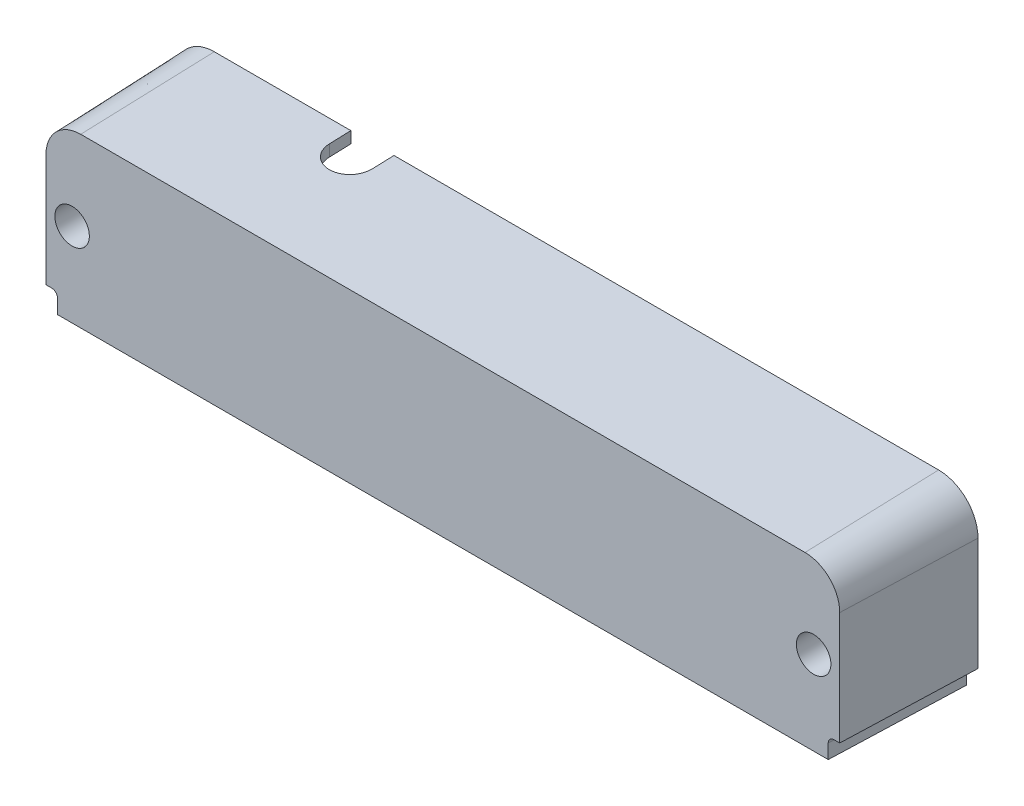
SolidWorks part; units mm, degrees
ref_plane "Front Plane" through (0, 0, 0) normal (0, 0, 1) x (1, 0, 0)
ref_plane "Top Plane" through (0, 0, 0) normal (0, 1, 0) x (1, 0, 0)
ref_plane "Right Plane" through (0, 0, 0) normal (1, 0, 0) x (0, 0, -1)
sketch "Sketch1" plane through (0, 0, 0) normal (0, 0, 1) x (1, 0, 0)
  line L1 (0, 0) -> (139.7, 0)
  line L2 (0, 0) -> (0, 23.15)
  line L3 (6.85, 30) -> (132.85, 30)
  line L4 (139.7, 0) -> (139.7, 23.15)
  arc A0 (139.7, 23.15) -> (132.85, 30) centre (132.85, 23.15) ccw
  arc A1 (0, 23.15) -> (6.85, 30) centre (6.85, 23.15) cw
  point P6 (139.7, 30)
  point P9 (0, 30)
  dimension "D3" = 6.85
  dimension "D1" = 30
  dimension "D2" = 139.7
extrude "Extrude1" add sketch "Sketch1" along normal blind 23.24 draft 2
shell "Shell2" thickness 2
sketch "Sketch2" plane through (0, 0, 23.24) normal (0, 0, 1) x (1, 0, 0)
  line L1 (-5.8064, 0.8116) -> (146.32, 0.8116)
  line L2 (-5.8064, 0.8116) -> (-5.8064, 0)
  line L3 (-5.8064, 0) -> (146.32, 0)
  line L4 (146.32, 0.8116) -> (146.32, 0)
extrude "Extrude2" add sketch "Sketch2" against normal through all
sketch "Sketch4" plane through (0, 0.8116, 0) normal (0, 1, 0) x (-1, 0, 0)
  line L4 (-0.8116, 23.24) -> (0, 0)
  line L5 (0, 0) -> (5.8064, 0)
  line L6 (5.8064, 0) -> (5.8064, 23.24)
  line L7 (5.8064, 23.24) -> (-0.8116, 23.24)
  line L8 (-0.8116, 23.24) -> (0, 0)
  line L9 (0, 0) -> (5.8064, 0)
  line L10 (5.8064, 0) -> (5.8064, 23.24)
  line L11 (5.8064, 23.24) -> (-0.8116, 23.24)
  line L12 (-139.7, 0) -> (-138.8884, 23.24)
  line L13 (-138.8884, 23.24) -> (-146.32, 23.24)
  line L14 (-146.32, 23.24) -> (-146.32, 0)
  line L15 (-146.32, 0) -> (-139.7, 0)
  line L16 (-139.7, 0) -> (-138.8884, 23.24)
  line L17 (-138.8884, 23.24) -> (-146.32, 23.24)
  line L18 (-146.32, 23.24) -> (-146.32, 0)
  line L19 (-146.32, 0) -> (-139.7, 0)
  dimension "D1" = 0
  dimension "D2" = 0
extrude "Cut-Extrude1" cut sketch "Sketch4" against normal through all
sketch "Sketch5" plane through (0, 0, 23.24) normal (0, 0, 1) x (1, 0, 0)
  line L0 (0.8116, 23.15) -> (0.8116, 0) construction
  line L1 (0.8116, 18.5934) -> (5.3516, 18.5934)
  line L2 (0.8116, 18.5934) -> (0.8116, 10.5934)
  line L3 (0.8116, 10.5934) -> (5.3516, 10.5934)
  line L4 (132.85, 29.1884) -> (6.85, 29.1884) construction
  line L5 (138.8884, 0) -> (138.8884, 23.15) construction
  line L6 (138.8884, 18.5934) -> (134.3484, 18.5934)
  line L7 (138.8884, 18.5934) -> (138.8884, 10.5934)
  line L8 (138.8884, 10.5934) -> (134.3484, 10.5934)
  arc A0 (5.3516, 10.5934) -> (5.3516, 18.5934) centre (5.3516, 14.5934) ccw
  arc A1 (134.3484, 18.5934) -> (134.3484, 10.5934) centre (134.3484, 14.5934) ccw
  dimension "D1" = 8
  dimension "D2" = 8
  dimension "D3" = 4.54
  dimension "D4" = 4.54
  dimension "D5" = 10.595
  dimension "D6" = 10.595
extrude "Extrude3" add sketch "Sketch5" against normal through all draft 1
sketch "Sketch7" plane through (0, 0, 23.24) normal (0, 0, 1) x (1, 0, 0)
  circle A0 centre (134.3484, 14.5934) radius 3
  circle A1 centre (5.3516, 14.5934) radius 3
extrude "Cut-Extrude2" cut sketch "Sketch7" against normal blind 15
sketch "Sketch8" plane through (0, 0, 23.24) normal (0, 0, 1) x (1, 0, 0)
  circle A0 centre (5.3516, 14.5934) radius 1.75
  circle A1 centre (134.3484, 14.5934) radius 1.75
extrude "Cut-Extrude4" cut sketch "Sketch8" against normal through all draft 1
sketch "Sketch10" plane through (0, 29.9635, 1.0463) normal (0, 0.9994, 0.0349) x (-1, 0, 0)
  line L0 (-132.85, -1.047) -> (-6.85, -1.047) construction
  line L3 (-38.1024, 2.703) -> (-38.1024, -1.047)
  line L4 (-38.1024, -1.047) -> (-30.6024, -1.047)
  line L5 (-30.6024, 2.703) -> (-30.6024, -1.047)
  arc A0 (-30.6024, 2.703) -> (-38.1024, 2.703) centre (-34.3524, 2.703) ccw
ref_plane "Plane1" through (0, 30, 0) normal (0, -1, 0) x (1, 0, 0)
sketch "Sketch13" plane through (0, 30, 0) normal (0, -1, 0) x (1, 0, 0)
  line L0 (30.6024, 3.7477) -> (30.6024, 0) construction
  line L1 (38.1024, 0) -> (30.6024, 0) construction
  line L2 (38.1024, 3.7477) -> (38.1024, 0) construction
  line L3 (30.6024, 3.7477) -> (30.6024, 0)
  line L4 (38.1024, 0) -> (30.6024, 0)
  line L5 (38.1024, 3.7477) -> (38.1024, 0)
  ellipse E0 centre (34.3524, 3.7477) end of major axis (38.1024, 3.7477) minor radius 3.7477 (38.1024, 3.7477) -> (30.6024, 3.7477) ccw construction
  ellipse E1 centre (34.3524, 3.7477) end of major axis (38.1024, 3.7477) minor radius 3.7477 (38.1024, 3.7477) -> (30.6024, 3.7477) ccw
extrude "Cut-Extrude8" cut sketch "Sketch13" along normal up to next
ref_plane "Plane2" through (0, 0, 0) normal (-1, 0, 0) x (0, 0, 1)
sketch "Sketch14" plane through (0, 0, 0) normal (-1, 0, 0) x (0, 0, 1)
  line L0 (0, 23.15) -> (0, 0) construction
  line L1 (0, 9.9991) -> (5, 9.9991)
  line L2 (0, 9.9991) -> (0, 4.9991)
  line L3 (0, 4.9991) -> (5, 4.9991)
  line L4 (6, 8.9991) -> (6, 5.9991)
  line L6 (0, 18.9991) -> (5, 18.9991)
  line L7 (0, 18.9991) -> (0, 23.9991)
  line L8 (0, 23.9991) -> (5, 23.9991)
  line L9 (6, 19.9991) -> (6, 22.9991)
  arc A0 (6, 5.9991) -> (5, 4.9991) centre (5, 5.9991) cw
  arc A1 (5, 9.9991) -> (6, 8.9991) centre (5, 8.9991) cw
  arc A2 (6, 19.9991) -> (5, 18.9991) centre (5, 19.9991) cw
  arc A3 (5, 23.9991) -> (6, 22.9991) centre (5, 22.9991) cw
  point P12 (6, 4.9991)
  point P15 (6, 9.9991)
  point P18 (6, 18.9991)
  point P21 (6, 23.9991)
  dimension "D5" = 1
  dimension "D1" = 5
  dimension "D2" = 5
  dimension "D3" = 6
  dimension "D4" = 6
  dimension "D6" = 9
  dimension "D7" = 1
extrude "Cut-Extrude9" cut sketch "Sketch14" against normal up to next
fillet "Fillet3" radius 2 4 edges at (2.0012, 18.5934, 0) (2.0885, 18.9991, 2.5) (2.2005, 19.292, 5.7071) (2.3721, 18.3732, 10.62)
fillet "Fillet4" radius 2 4 edges at (2.2005, 9.7062, 5.7071) (2.0885, 9.9991, 2.5) (2.0012, 10.4991, 0) (2.3721, 10.8137, 10.62)
fillet "Fillet5" radius 2 1 edges at (2.3721, 2.3721, 10.62)
fillet "Fillet6" radius 2 1 edges at (137.3279, 10.8137, 10.62)
fillet "Fillet7" radius 2 1 edges at (137.3279, 18.3732, 10.62)
fillet "Fillet8" radius 2 1 edges at (137.3279, 2.3721, 10.62)
sketch "Sketch15" plane through (0, 0, 0) normal (0, -1, 0) x (1, 0, 0)
  line L0 (0, 0) -> (139.7, 0) construction
  line L11 (15.6818, 11.06) -> (15.6818, 0)
  line L12 (20.6818, 0) -> (15.6818, 0)
  line L13 (20.6818, 11.06) -> (20.6818, 0)
  line L14 (20.6818, 11.06) -> (20.6818, 13.74)
  line L15 (20.6818, 13.74) -> (15.6818, 13.74)
  line L16 (120.1278, 11.06) -> (120.1278, 14.06)
  line L17 (120.1278, 11.06) -> (120.1278, 0)
  line L18 (124.7896, 0) -> (120.1278, 0)
  line L19 (124.7896, 11.06) -> (124.7896, 0)
  line L20 (124.7896, 11.06) -> (124.7896, 14.06)
  line L21 (120.1278, 14.06) -> (124.7896, 14.06)
  line L23 (15.6818, 11.06) -> (15.6818, 13.74)
extrude "Cut-Extrude10" [suppressed] cut sketch "Sketch15" against normal up to next
sketch "Sketch16" plane through (0, 0, 0) normal (0, -1, 0) x (1, 0, 0)
  line L0 (139.7, 0) -> (138.8884, 23.24)
  line L1 (0, 0) -> (0.8116, 23.24)
  line L2 (1.9988, -0.0698) -> (2.8128, 23.24)
  line L3 (137.7012, -0.0698) -> (136.8872, 23.24)
  line L4 (0, 0) -> (1.9988, -0.0698)
  line L5 (137.7012, -0.0698) -> (139.7, 0)
  line L6 (136.8872, 23.24) -> (138.8884, 23.24)
  line L7 (0.8116, 23.24) -> (138.8884, 23.24) construction
  line L10 (2.8128, 23.24) -> (1.053, 23.24)
  line L11 (1.053, 23.24) -> (0.8116, 23.24)
extrude "Cut-Extrude11" cut sketch "Sketch16" against normal blind 3.5
sketch "Sketch17" plane through (0, 0, 0) normal (0, -1, 0) x (1, 0, 0)
  line L12 (122.96, 14.06) -> (122.96, 11.06)
  line L13 (127.6217, 14.06) -> (122.96, 14.06)
  line L14 (127.6217, 11.06) -> (127.6217, 14.06)
  line L15 (127.6217, 0) -> (127.6217, 11.06)
  line L16 (122.96, 0) -> (127.6217, 0)
  line L17 (122.96, 11.06) -> (122.96, 0)
  line L24 (18.514, 13.74) -> (18.514, 11.06)
  line L25 (23.514, 13.74) -> (18.514, 13.74)
  line L26 (23.514, 11.06) -> (23.514, 13.74)
  line L27 (23.514, 0) -> (23.514, 11.06)
  line L28 (18.514, 0) -> (23.514, 0)
  line L29 (18.514, 11.06) -> (18.514, 0)
extrude "Cut-Extrude12" cut sketch "Sketch17" against normal up to next
sketch "Sketch18" plane through (0, 0, 0) normal (0, 0, -1) x (-1, 0, 0)
  line L1 (-2.0012, 4.9991) -> (-4, 4.9991)
  line L2 (-2.0012, 4.9991) -> (-2.0012, 2.0012)
  line L3 (-2.0012, 2.0012) -> (-4, 2.0012)
  line L4 (-4, 4.9991) -> (-4, 2.0012)
  line L5 (-135.7, 2.0012) -> (-137.6988, 2.0012)
  line L6 (-135.7, 2.0012) -> (-135.7, 4)
  line L7 (-135.7, 4) -> (-137.6988, 4)
  line L8 (-137.6988, 2.0012) -> (-137.6988, 4)
fillet "Fillet9" radius 1 1 edges at (137.293, 3.5, 11.62)
fillet "Fillet10" radius 1 1 edges at (2.407, 3.5, 11.62)
sketch "Sketch20" plane through (0, 0, 0) normal (0, -1, 0) x (1, 0, 0)
  line L6 (83.8, 0) -> (79.4, 0)
  line L7 (79.4, 3.833) -> (79.4, 0)
  line L8 (79.4, 3.833) -> (79.4, 13.74)
  line L9 (79.4, 13.74) -> (83.8, 13.74)
  line L10 (83.8, 13.74) -> (83.8, 3.833)
  line L11 (83.8, 3.833) -> (83.8, 0)
extrude "Cut-Extrude14" cut sketch "Sketch20" against normal up to next
